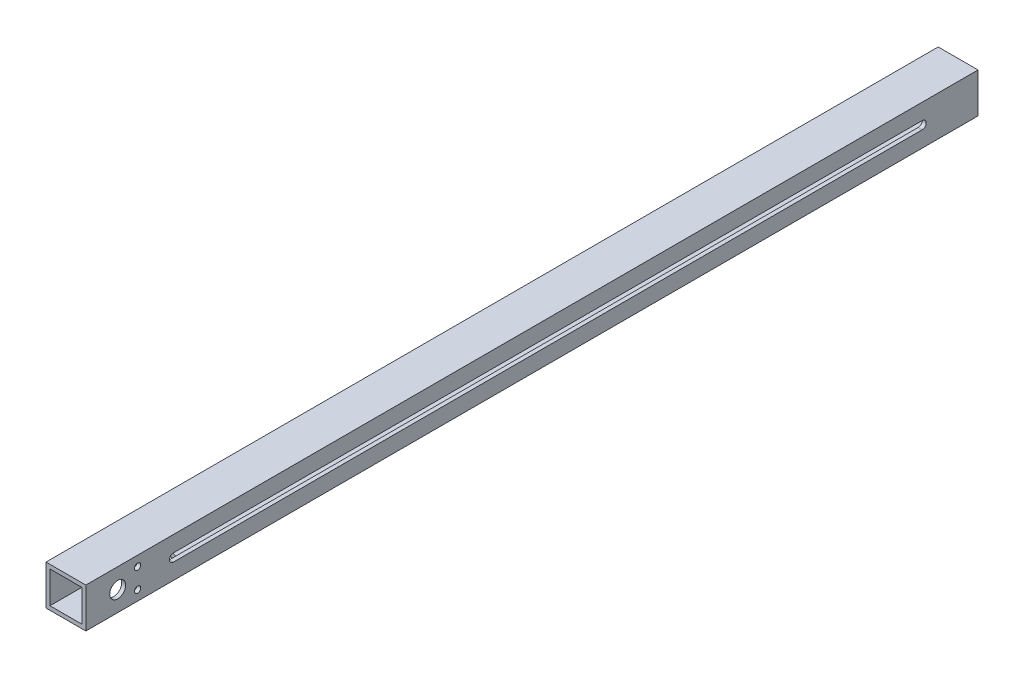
SolidWorks part; units mm, degrees
ref_plane "Front Plane" through (0, 0, 0) normal (0, 0, 1) x (1, 0, 0)
ref_plane "Top Plane" through (0, 0, 0) normal (0, 1, 0) x (1, 0, 0)
ref_plane "Right Plane" through (0, 0, 0) normal (1, 0, 0) x (0, 0, -1)
sketch "Sketch1" plane through (0, 0, 0) normal (0, 0, 1) x (1, 0, 0)
  line L0 (-15.875, 15.875) -> (15.875, 15.875)
  line L1 (-12.7, -12.7) -> (12.7, -12.7)
  line L2 (-12.7, -12.7) -> (-12.7, 12.7)
  line L3 (-12.7, 12.7) -> (12.7, 12.7)
  line L4 (12.7, -12.7) -> (12.7, 12.7)
  line L5 (-12.7, -12.7) -> (12.7, 12.7) construction
  line L6 (-12.7, 12.7) -> (12.7, -12.7) construction
  line L7 (15.875, -15.875) -> (15.875, 15.875)
  line L8 (-15.875, -15.875) -> (15.875, -15.875)
  line L9 (-15.875, -15.875) -> (-15.875, 15.875)
  point P0 (0, 0)
  dimension "D1" = 25.4
  dimension "D2" = 25.4
  dimension "D3" = 3.175
extrude "Boss-Extrude1" add sketch "Sketch1" against normal blind 711.2
sketch "Sketch2" plane through (15.875, 0, 0) normal (1, 0, 0) x (0, 0, -1)
  line L0 (0, -15.875) -> (0, 15.875) construction
  line L1 (25.4, 0) -> (41.275, 0) construction
  line L2 (41.275, 7.9375) -> (41.275, -7.9375) construction
  circle A0 centre (25.4, 0) radius 6.35
  circle A1 centre (41.275, 7.9375) radius 2.4892
  circle A2 centre (41.275, -7.9375) radius 2.4892
  point P8 (41.275, 0)
  dimension "D1" = 12.7
  dimension "D4" = 4.9784
  dimension "D2" = 25.4
  dimension "D3" = 15.875
  dimension "D5" = 15.875
extrude "Cut-Extrude1" cut sketch "Sketch2" against normal through all
sketch "Sketch3" plane through (15.875, 0, 0) normal (1, 0, 0) x (0, 0, -1)
  line L1 (69.85, 0) -> (666.75, 0) construction
  line L2 (69.85, 3.175) -> (666.75, 3.175)
  line L3 (69.85, -3.175) -> (666.75, -3.175)
  line L4 (0, -15.875) -> (0, 15.875) construction
  line L6 (711.2, -15.875) -> (711.2, 15.875) construction
  arc A1 (69.85, 3.175) -> (69.85, -3.175) centre (69.85, 0) ccw
  arc A2 (666.75, -3.175) -> (666.75, 3.175) centre (666.75, 0) ccw
  point P2 (368.3, 0)
  dimension "D2" = 3.175
  dimension "D1" = 69.85
  dimension "D3" = 44.45
extrude "Cut-Extrude2" cut sketch "Sketch3" against normal blind 3.175
sketch "Sketch4" plane through (-15.875, 0, 0) normal (-1, 0, 0) x (0, 0, 1)
  line L0 (-711.2, 15.875) -> (-711.2, -15.875) construction
  line L1 (-711.2, 12.7) -> (-622.3, 12.7)
  line L2 (-711.2, 12.7) -> (-711.2, -12.7)
  line L3 (-711.2, -12.7) -> (-622.3, -12.7)
  line L4 (-622.3, 12.7) -> (-622.3, -12.7)
  line L5 (-711.2, 15.875) -> (0, 15.875) construction
  line L6 (-711.2, -15.875) -> (0, -15.875) construction
  dimension "D1" = 3.175
  dimension "D2" = 3.175
  dimension "D3" = 88.9
extrude "Cut-Extrude3" cut sketch "Sketch4" against normal blind 3.175
sketch "Sketch5" plane through (-15.875, 0, 0) normal (-1, 0, 0) x (0, 0, 1)
  line L0 (-508, 0) -> (-736.6, 0) construction
  line L4 (-508, -9.525) -> (-508, 9.525)
  line L5 (-508, 9.525) -> (-1016, 9.525)
  line L6 (-1016, 9.525) -> (-1016, -9.525)
  line L7 (-1016, -9.525) -> (-508, -9.525)
  line L8 (-508, -9.525) -> (-508, 9.525)
  line L9 (-508, 9.525) -> (-1016, 9.525)
  line L10 (-1016, 9.525) -> (-1016, -9.525)
  line L11 (-1016, -9.525) -> (-508, -9.525)
  dimension "D1" = 0
sketch "Sketch6" plane through (0, -15.875, 0) normal (0, -1, 0) x (1, 0, 0)
  line L0 (0, -25.4) -> (0, -76.2) construction
  line L1 (8.89, -25.4) -> (8.89, -76.2)
  line L2 (-8.89, -25.4) -> (-8.89, -76.2)
  line L4 (-15.875, 0) -> (15.875, 0) construction
  arc A0 (8.89, -25.4) -> (-8.89, -25.4) centre (0, -25.4) ccw
  arc A1 (-8.89, -76.2) -> (8.89, -76.2) centre (0, -76.2) ccw
  point P3 (0, -50.8)
  dimension "D1" = 8.89
  dimension "D2" = 25.4
  dimension "D3" = 50.8
extrude "Cut-Extrude4" cut sketch "Sketch6" against normal up to next
fillet "Fillet1" radius 6.35 2 edges at (-14.2875, 12.7, -622.3) (-14.2875, -12.7, -622.3)
